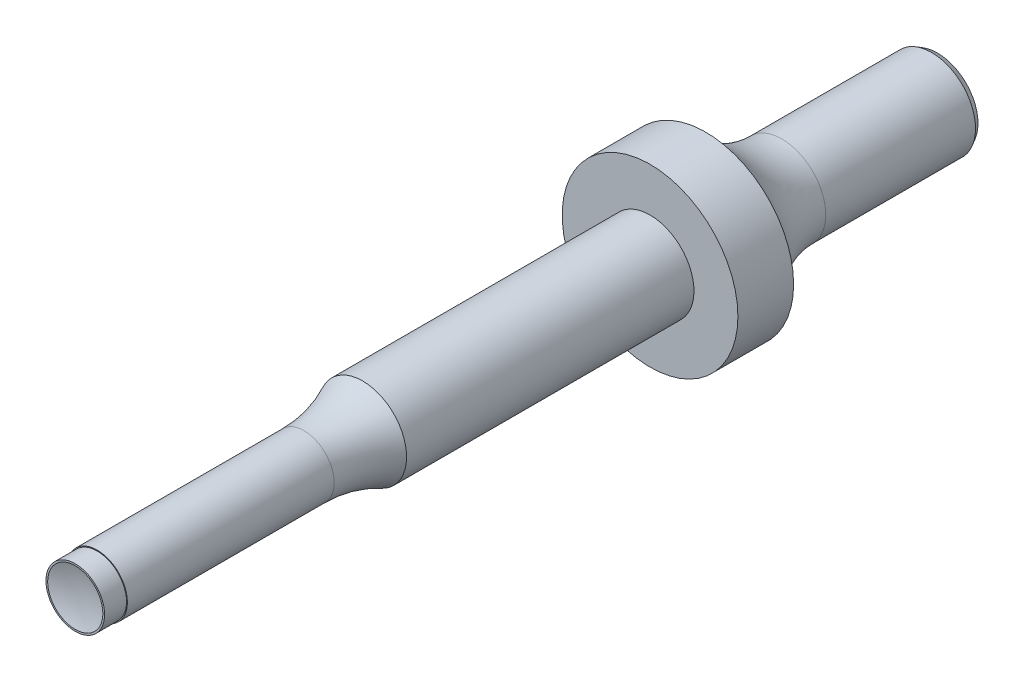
SolidWorks part; units mm, degrees
ref_plane "Front Plane" through (0, 0, 0) normal (0, 0, 1) x (1, 0, 0)
ref_plane "Top Plane" through (0, 0, 0) normal (0, 1, 0) x (1, 0, 0)
ref_plane "Right Plane" through (0, 0, 0) normal (1, 0, 0) x (0, 0, -1)
sketch "Sketch1" plane through (0, 0, 0) normal (0, 0, 1) x (1, 0, 0)
  circle A0 centre (0, 0) radius 5.095
  dimension "D1" = 10.19
extrude "Boss-Extrude1" add sketch "Sketch1" against normal blind 100
sketch "Sketch2" plane through (0, 0, 0) normal (0, 0, 1) x (1, 0, 0)
  circle A0 centre (0, 0) radius 3.5
  dimension "D1" = 7
extrude "Cut-Extrude1" cut sketch "Sketch2" against normal blind 33.3333 flip side to cut
sketch "Sketch3" plane through (0, 0, 0) normal (0, 0, 1) x (1, 0, 0)
  circle A0 centre (0, 0) radius 3.4
  dimension "D1" = 6.8
extrude "Cut-Extrude2" cut sketch "Sketch3" against normal blind 2.5475 flip side to cut
sketch "Sketch4" plane through (0, 0, 0) normal (1, 0, 0) x (0, 0, -1)
  line L0 (0, 0) -> (0, 3.2)
  line L1 (0, 3.4) -> (0, -3.4) construction
  line L2 (0.5155, 0) -> (0.5155, 3.2) construction
  line L3 (0, 0) -> (0.5155, 0)
  line L4 (0, 0) -> (0, -3.2) construction
  arc A0 (0.5155, 0) -> (0, 3.2) centre (-9.6745, 0) ccw
  dimension "D2" = 10.19
  dimension "D1" = 6.4
revolve "Cut-Revolve1" cut sketch "Sketch4" angle 360 about L3
chamfer "Chamfer1" distance 0.6793 angle 30 1 edges at (5.095, 0, -100)
sketch "Sketch5" plane through (0, 0, 0) normal (1, 0, 0) x (0, 0, -1)
  line L0 (33.3333, 0) -> (26.5352, 0)
  line L1 (33.3333, 5.095) -> (33.3333, -5.095) construction
  line L2 (26.5352, 0) -> (26.5352, 3.5)
  line L3 (33.3333, 3.5) -> (2.5475, 3.5) construction
  line L4 (33.3333, 5.095) -> (33.3333, 0)
  line L5 (26.5352, 3.5) -> (33.3333, 3.5) construction
  arc A0 (26.5352, 3.5) -> (33.3333, 5.095) centre (26.5352, 18.785) ccw
  dimension "D1" = 15.285
revolve "Revolve1" add sketch "Sketch5" angle 360 about L0
sketch "Sketch6" plane through (0, 0, 0) normal (1, 0, 0) x (0, 0, -1)
  line L0 (66.6667, 0) -> (81.9517, 0)
  line L1 (66.6667, 0) -> (66.6667, 10.19)
  line L2 (66.6667, 10.19) -> (73.1269, 10.19)
  line L3 (81.9517, 0) -> (81.9517, 5.095)
  line L4 (99.3207, 5.095) -> (33.3333, 5.095) construction
  line L5 (81.9517, 5.095) -> (66.6667, 5.095) construction
  line L6 (100, -5.095) -> (100, 5.095) construction
  arc A0 (81.9517, 5.095) -> (73.1269, 10.19) centre (81.9517, 15.285) cw
  dimension "D2" = 10.19
  dimension "D1" = 33.3333
  dimension "D3" = 15.285
revolve "Revolve2" add sketch "Sketch6" angle 360 about L0
sketch "Sketch7" plane through (0, 0, -100) normal (0, 0, -1) x (-1, 0, 0)
  line L9 (-8.6234, 1.9603) -> (-4.7028, 1.9603)
  line L10 (-8.6234, 1.9603) -> (-8.6234, -1.9603)
  line L11 (-8.6234, -1.9603) -> (-4.7028, -1.9603)
  line L12 (-4.7028, 1.9603) -> (-4.7028, -1.9603)
  circle A5 centre (0, 0) radius 5.095 construction
  circle A6 centre (0, 0) radius 4.7028 construction
  point P8 (-4.7028, 0)
extrude "Cut-Extrude3" [suppressed] cut sketch "Sketch7" against normal through all
